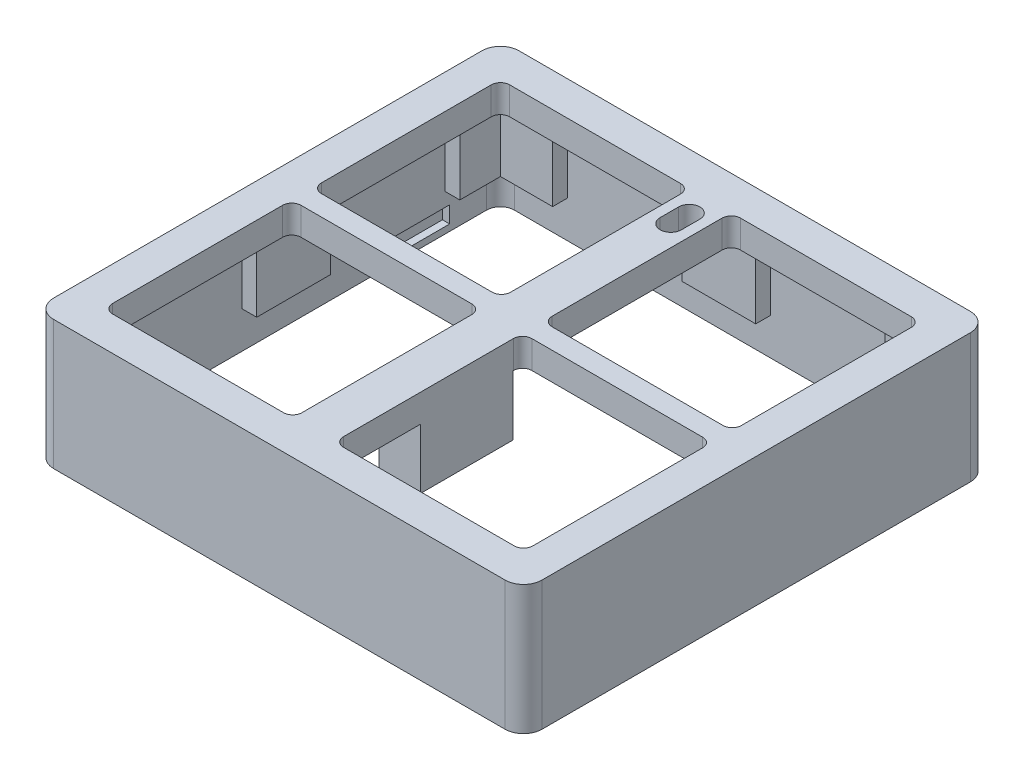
SolidWorks part; units mm, degrees
ref_plane "Спереди" through (0, 0, 0) normal (0, 0, 1) x (1, 0, 0)
ref_plane "Сверху" through (0, 0, 0) normal (0, 1, 0) x (1, 0, 0)
ref_plane "Справа" through (0, 0, 0) normal (1, 0, 0) x (0, 0, -1)
sketch "Эскиз1" plane through (0, 0, 0) normal (0, 1, 0) x (1, 0, 0)
  line L0 (26.45, 25.2) -> (-26.45, 25.2)
  line L1 (25.25, -24) -> (-25.25, -24)
  line L2 (25.25, -24) -> (25.25, 24)
  line L3 (25.25, 24) -> (-25.25, 24)
  line L4 (-25.25, -24) -> (-25.25, 24)
  line L5 (25.25, -24) -> (-25.25, 24) construction
  line L6 (25.25, 24) -> (-25.25, -24) construction
  line L7 (-26.45, -25.2) -> (-26.45, 25.2)
  line L8 (26.45, -25.2) -> (-26.45, -25.2)
  line L9 (26.45, -25.2) -> (26.45, 25.2)
  point P0 (0, 0)
  dimension "D2" = 50.5
  dimension "D3" = 48
  dimension "D1" = 1.2
extrude "Бобышка-Вытянуть1" add sketch "Эскиз1" along normal blind 14
ref_plane "Плоскость1" through (0, 4, 0) normal (0, -1, 0) x (-1, 0, 0)
sketch "Эскиз2" plane through (0, 4, 0) normal (0, -1, 0) x (-1, 0, 0)
  line L1 (23.65, 22.4) -> (-23.65, 22.4)
  line L2 (23.65, 22.4) -> (23.65, -22.4)
  line L3 (23.65, -22.4) -> (-23.65, -22.4)
  line L4 (-23.65, 22.4) -> (-23.65, -22.4)
  line L5 (23.65, 22.4) -> (-23.65, -22.4) construction
  line L6 (23.65, -22.4) -> (-23.65, 22.4) construction
  line L20 (25.25, 24) -> (-25.25, 24)
  line L21 (-25.25, 24) -> (-25.25, -24)
  line L22 (-25.25, -24) -> (25.25, -24)
  line L23 (25.25, -24) -> (25.25, 24)
  line L24 (25.25, 24) -> (-25.25, 24)
  line L25 (-25.25, 24) -> (-25.25, -24)
  line L26 (-25.25, -24) -> (25.25, -24)
  line L27 (25.25, -24) -> (25.25, 24)
  point P0 (0, 0)
  dimension "D2" = 1.6
  dimension "D3" = 1.6
  dimension "D1" = 0
extrude "Бобышка-Вытянуть2" add sketch "Эскиз2" against normal up to surface (10 mm away)
fillet "Скругление1" radius 2 4 edges at (26.45, 7, -25.2) (26.45, 7, 25.2) (-26.45, 7, 25.2) (-26.45, 7, -25.2)
fillet "Скругление2" radius 1.5 4 edges at (25.25, 2, -24) (25.25, 2, 24) (-25.25, 2, 24) (-25.25, 2, -24)
ref_plane "Плоскость3" through (0, 14, 0) normal (0, 1, 0) x (1, 0, 0)
sketch "Эскиз3" plane through (0, 14, 0) normal (0, 1, 0) x (1, 0, 0)
  line L0 (22.75, 1.1) -> (22.75, 21.5)
  line L1 (-2.25, -21.5) -> (-22.75, -21.5)
  line L2 (-2.25, 21.5) -> (-22.75, 21.5)
  line L24 (-2.25, 21.5) -> (-2.25, 1.1)
  line L25 (22.75, -21.5) -> (2.25, -21.5)
  line L26 (22.75, -21.5) -> (22.75, -1.1)
  line L27 (22.75, 21.5) -> (2.25, 21.5)
  line L28 (-24.45, -25.2) -> (24.45, -25.2)
  line L29 (26.45, -23.2) -> (26.45, 23.2)
  line L30 (24.45, 25.2) -> (-24.45, 25.2)
  line L31 (-26.45, 23.2) -> (-26.45, -23.2)
  line L32 (-24.45, -25.2) -> (24.45, -25.2)
  line L33 (26.45, -23.2) -> (26.45, 23.2)
  line L34 (24.45, 25.2) -> (-24.45, 25.2)
  line L35 (-26.45, 23.2) -> (-26.45, -23.2)
  line L36 (-22.75, -21.5) -> (-22.75, -1.1)
  line L37 (22.75, -21.5) -> (-22.75, 21.5) construction
  line L38 (22.75, 21.5) -> (-22.75, -21.5) construction
  line L39 (2.25, 21.5) -> (2.25, 1.1)
  line L40 (-26.45, 0) -> (26.45, 0) construction
  line L41 (0, 25.2) -> (0, -25.2) construction
  line L42 (-22.75, 1.1) -> (-2.25, 1.1)
  line L43 (-22.75, -1.1) -> (-2.25, -1.1)
  line L44 (2.25, 1.1) -> (22.75, 1.1)
  line L45 (2.25, -1.1) -> (22.75, -1.1)
  line L46 (-2.25, -1.1) -> (-2.25, -21.5)
  line L47 (2.25, -1.1) -> (2.25, -21.5)
  line L48 (-22.75, 1.1) -> (-22.75, 21.5)
  arc A19 (-26.45, -23.2) -> (-24.45, -25.2) centre (-24.45, -23.2) ccw
  arc A20 (24.45, -25.2) -> (26.45, -23.2) centre (24.45, -23.2) ccw
  arc A21 (26.45, 23.2) -> (24.45, 25.2) centre (24.45, 23.2) ccw
  arc A22 (-24.45, 25.2) -> (-26.45, 23.2) centre (-24.45, 23.2) ccw
  arc A23 (-26.45, -23.2) -> (-24.45, -25.2) centre (-24.45, -23.2) ccw
  arc A24 (24.45, -25.2) -> (26.45, -23.2) centre (24.45, -23.2) ccw
  arc A25 (26.45, 23.2) -> (24.45, 25.2) centre (24.45, 23.2) ccw
  arc A26 (-24.45, 25.2) -> (-26.45, 23.2) centre (-24.45, 23.2) ccw
  point P0 (0, 0)
extrude "Бобышка-Вытянуть3" add sketch "Эскиз3" against normal blind 3
ref_plane "Плоскость4" through (0, 14, 0) normal (0, 1, 0) x (1, 0, 0)
sketch "Эскиз4" plane through (0, 14, 0) normal (0, 1, 0) x (1, 0, 0)
  line L0 (0, 25.2) -> (0, -25.2) construction
  line L1 (24.45, 25.2) -> (-24.45, 25.2) construction
  line L2 (-24.45, -25.2) -> (24.45, -25.2) construction
  line L3 (0, 19.2) -> (0, 17.2) construction
  line L4 (1.15, 19.2) -> (1.15, 17.2)
  line L5 (-1.15, 19.2) -> (-1.15, 17.2)
  arc A1 (1.15, 19.2) -> (-1.15, 19.2) centre (0, 19.2) ccw
  arc A2 (-1.15, 17.2) -> (1.15, 17.2) centre (0, 17.2) ccw
  point P10 (0, 18.2)
  dimension "D1" = 2.3
  dimension "D2" = 2
  dimension "D3" = 6
extrude "Вырез-Вытянуть1" cut sketch "Эскиз4" against normal through all
ref_plane "Плоскость27" through (0, 11, 0) normal (0, -1, 0) x (-1, 0, 0)
sketch "Эскиз5" plane through (0, 11, 0) normal (0, -1, 0) x (-1, 0, 0)
  line L0 (0, -22.4) -> (0, 23.9276) construction
  line L1 (-23.65, -22.4) -> (23.65, -22.4) construction
  line L2 (2.25, -21.5) -> (2.25, -1.1) construction
  line L3 (-2.25, -12.15) -> (2.25, -12.15)
  line L4 (-2.25, -12.15) -> (-2.25, -2.15)
  line L5 (-2.25, -2.15) -> (2.25, -2.15)
  line L6 (2.25, -12.15) -> (2.25, -2.15)
  line L7 (-2.25, -12.15) -> (2.25, -2.15) construction
  line L8 (-2.25, -2.15) -> (2.25, -12.15) construction
  circle A1 centre (0.4975, -7.2) radius 1.15
  point P5 (0, -7.15)
  dimension "D3" = 2.3
  dimension "D1" = 10
  dimension "D2" = 7.15
  dimension "D4" = 0.5
  dimension "D5" = 7.2
extrude "Бобышка-Вытянуть4" add sketch "Эскиз5" along normal offset from surface (6.5 mm away) 0.5
ref_plane "Плоскость34" through (0, 14, 0) normal (0, 1, 0) x (1, 0, 0)
sketch "Эскиз7" plane through (0, 14, 0) normal (0, 1, 0) x (1, 0, 0)
  line L0 (-12.5, 21.5) -> (-12.5, -21.5) construction
  line L1 (-2.25, 21.5) -> (-22.75, 21.5) construction
  line L2 (-22.75, -21.5) -> (-2.25, -21.5) construction
  line L3 (12.5, 21.5) -> (12.5, -21.5) construction
  line L4 (22.75, 21.5) -> (2.25, 21.5) construction
  line L5 (2.25, -21.5) -> (22.75, -21.5) construction
  line L6 (-22.75, 1.1) -> (-2.25, 1.1) construction
  line L7 (-14.5, 21.5) -> (-10.5, 21.5)
  line L8 (-14.5, 21.5) -> (-14.5, 20)
  line L9 (-14.5, 20) -> (-10.5, 20)
  line L10 (-10.5, 21.5) -> (-10.5, 20)
  line L11 (-14.5, 1.1) -> (-10.5, 1.1)
  line L12 (-14.5, 1.1) -> (-14.5, 2.3)
  line L13 (-14.5, 2.3) -> (-10.5, 2.3)
  line L14 (-10.5, 1.1) -> (-10.5, 2.3)
  line L15 (-2.25, -1.1) -> (-22.75, -1.1) construction
  line L16 (-14.5, -1.1) -> (-10.5, -1.1)
  line L17 (-14.5, -1.1) -> (-14.5, -2.3)
  line L18 (-14.5, -2.3) -> (-10.5, -2.3)
  line L19 (-10.5, -1.1) -> (-10.5, -2.3)
  line L20 (0, 25.2) -> (0, -25.2) construction
  line L21 (-14.5, -21.5) -> (-10.5, -21.5)
  line L22 (-14.5, -21.5) -> (-14.5, -20.3)
  line L23 (-14.5, -20.3) -> (-10.5, -20.3)
  line L24 (-10.5, -21.5) -> (-10.5, -20.3)
  line L25 (24.45, 25.2) -> (-24.45, 25.2) construction
  line L26 (-24.45, -25.2) -> (24.45, -25.2) construction
extrude "Бобышка-Вытянуть5" [suppressed] add sketch "Эскиз7" against normal blind 1 separate body
ref_plane "Плоскость35" through (0, 0, 0) normal (-1, 0, 0) x (0, 0, 1)
mirror "Зеркальное отражение1" [suppressed] about plane through (0, 0, 0) normal (-1, 0, 0)
ref_plane "Плоскость36" through (0, 0, 0) normal (1, 0, 0) x (0, 0, -1)
sketch "Эскиз8" plane through (0, 0, 0) normal (1, 0, 0) x (0, 0, -1)
  line L0 (25.2, 1.6) -> (-25.2, 1.6) construction
  line L1 (25.2, 0) -> (25.2, 14) construction
  line L2 (-25.2, 14) -> (-25.2, 0) construction
  line L3 (23.2, 0) -> (-23.2, 0) construction
  line L5 (-18.5, 0.7) -> (-11.5, 0.7)
  line L6 (-18.5, 0.7) -> (-18.5, 2.5)
  line L7 (-18.5, 2.5) -> (-11.5, 2.5)
  line L8 (-11.5, 0.7) -> (-11.5, 2.5)
  line L9 (-18.5, 0.7) -> (-11.5, 2.5) construction
  line L10 (-18.5, 2.5) -> (-11.5, 0.7) construction
  line L11 (11.5, 0.7) -> (18.5, 0.7)
  line L12 (11.5, 0.7) -> (11.5, 2.5)
  line L13 (11.5, 2.5) -> (18.5, 2.5)
  line L14 (18.5, 0.7) -> (18.5, 2.5)
  line L15 (11.5, 0.7) -> (18.5, 2.5) construction
  line L16 (11.5, 2.5) -> (18.5, 0.7) construction
  point P8 (-15, 1.6)
  point P13 (15, 1.6)
extrude "Вырез-Вытянуть2" cut sketch "Эскиз8" against normal offset from surface 0.42 and the other way offset from surface (26.03 mm away) 0.42
fillet "Скругление3" radius 1 16 edges at (2.25, 12.5, -21.5) (22.75, 12.5, -21.5) (22.75, 12.5, -1.1) (2.25, 12.5, -1.1) (2.25, 12.5, 1.1) (22.75, 12.5, 1.1) (22.75, 12.5, 21.5) (2.25, 12.5, 21.5) (-2.25, 12.5, 21.5) (-2.25, 12.5, 1.1) (-22.75, 12.5, 1.1) (-22.75, 12.5, 21.5) (-22.75, 12.5, -1.1) (-2.25, 12.5, -1.1) (-22.75, 12.5, -21.5) (-2.25, 12.5, -21.5)
ref_plane "Плоскость37" through (0, 11, 0) normal (0, -1, 0) x (-1, 0, 0)
sketch "Эскиз9" plane through (0, 11, 0) normal (0, -1, 0) x (-1, 0, 0)
  line L0 (25.25, 22.5) -> (25.25, -22.5) construction
  line L1 (25.25, -18) -> (22.75, -18)
  line L2 (25.25, -18) -> (25.25, -4)
  line L3 (25.25, -4) -> (22.75, -4)
  line L4 (22.75, -18) -> (22.75, -4)
  line L5 (22.75, -2.1) -> (22.75, -20.5) construction
  line L6 (25.25, -22.5) -> (25.25, 22.5) construction
  line L7 (25.25, 4) -> (22.75, 4)
  line L8 (25.25, 4) -> (25.25, 18)
  line L9 (25.25, 18) -> (22.75, 18)
  line L10 (22.75, 4) -> (22.75, 18)
  line L11 (22.75, 20.5) -> (22.75, 2.1) construction
  line L12 (0, -25.2) -> (0, 24.1418) construction
  line L13 (24.45, -25.2) -> (-24.45, -25.2) construction
  line L14 (0, 7.7) -> (0, -7.7) construction
  line L15 (-22.75, 4) -> (-22.75, 18)
  line L16 (-25.25, 18) -> (-22.75, 18)
  line L17 (-25.25, 4) -> (-25.25, 18)
  line L18 (-25.25, 4) -> (-22.75, 4)
  line L19 (-22.75, -18) -> (-22.75, -4)
  line L20 (-25.25, -4) -> (-22.75, -4)
  line L21 (-25.25, -18) -> (-25.25, -4)
  line L22 (-25.25, -18) -> (-22.75, -18)
  line L23 (23.75, -24) -> (-23.75, -24) construction
  line L24 (18, -24) -> (4, -24)
  line L25 (18, -24) -> (18, -22.4)
  line L26 (18, -22.4) -> (4, -22.4)
  line L27 (4, -24) -> (4, -22.4)
  line L28 (-23.65, -22.4) -> (23.65, -22.4) construction
  line L29 (-23.65, -22.4) -> (23.65, -22.4) construction
  line L30 (-4, -24) -> (-18, -24)
  line L31 (-4, -24) -> (-4, -22.4)
  line L32 (-4, -22.4) -> (-18, -22.4)
  line L33 (-18, -24) -> (-18, -22.4)
  line L34 (23.75, 24) -> (-23.75, 24) construction
  line L35 (-4, 24) -> (-18, 24)
  line L36 (-4, 24) -> (-4, 22.4)
  line L37 (-4, 22.4) -> (-18, 22.4)
  line L38 (-18, 24) -> (-18, 22.4)
  line L39 (23.65, 22.4) -> (-23.65, 22.4) construction
  line L40 (-23.75, 24) -> (23.75, 24) construction
  line L41 (18, 24) -> (4, 24)
  line L42 (18, 24) -> (18, 22.4)
  line L43 (18, 22.4) -> (4, 22.4)
  line L44 (4, 24) -> (4, 22.4)
  line L45 (23.65, 22.4) -> (-23.65, 22.4) construction
  dimension "D1" = 14
  dimension "D2" = 14
  dimension "D3" = 4
  dimension "D4" = 4
  dimension "D5" = 14
  dimension "D6" = 14
  dimension "D7" = 4
  dimension "D8" = 4
extrude "Вырез-Вытянуть3" cut sketch "Эскиз9" along normal up to surface (7 mm away)
equation "\"D5@Эскиз3\"= \"D4@Эскиз3\" / 2"
equation "\"D7@Эскиз3\"= \"D6@Эскиз3\" / 2"
equation "\"D6@Эскиз7\"= \"D5@Эскиз7\" / 2"
equation "\"D3@Эскиз8\"= \"D4@Эскиз8\""
equation "\"D5@Эскиз8\"= \"D6@Эскиз8\""
